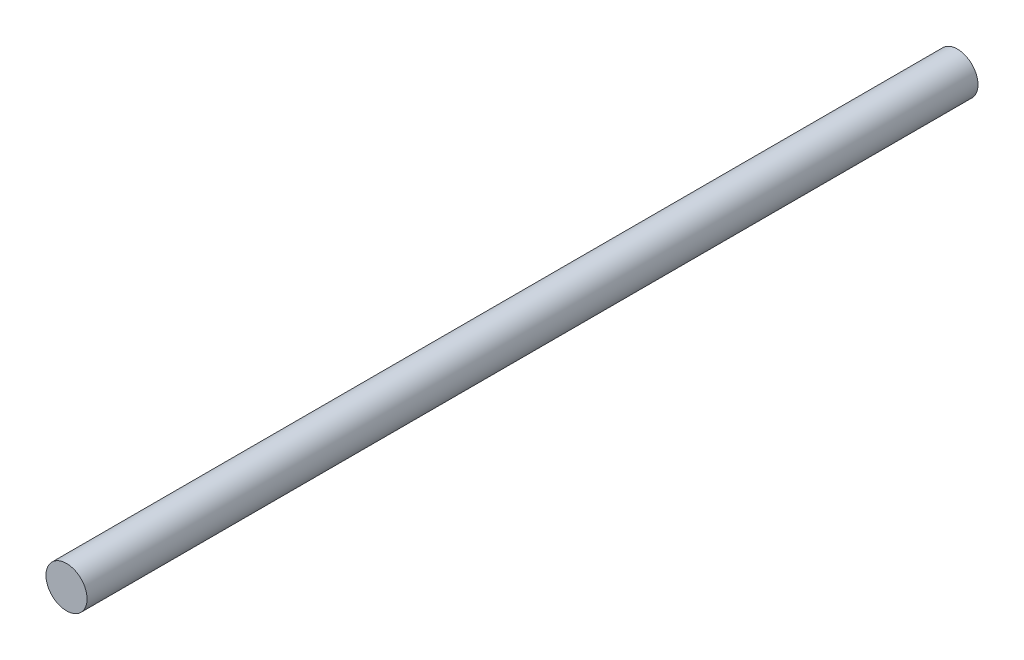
SolidWorks part; units mm, degrees
ref_plane "Front Plane" through (0, 0, 0) normal (0, 0, 1) x (1, 0, 0)
ref_plane "Top Plane" through (0, 0, 0) normal (0, 1, 0) x (1, 0, 0)
ref_plane "Right Plane" through (0, 0, 0) normal (1, 0, 0) x (0, 0, -1)
sketch "Sketch1" plane through (0, 0, 0) normal (0, 0, 1) x (1, 0, 0)
  circle A0 centre (0, 0) radius 30
  dimension "D1" = 60
extrude "Boss-Extrude1" add sketch "Sketch1" against normal blind 1300
